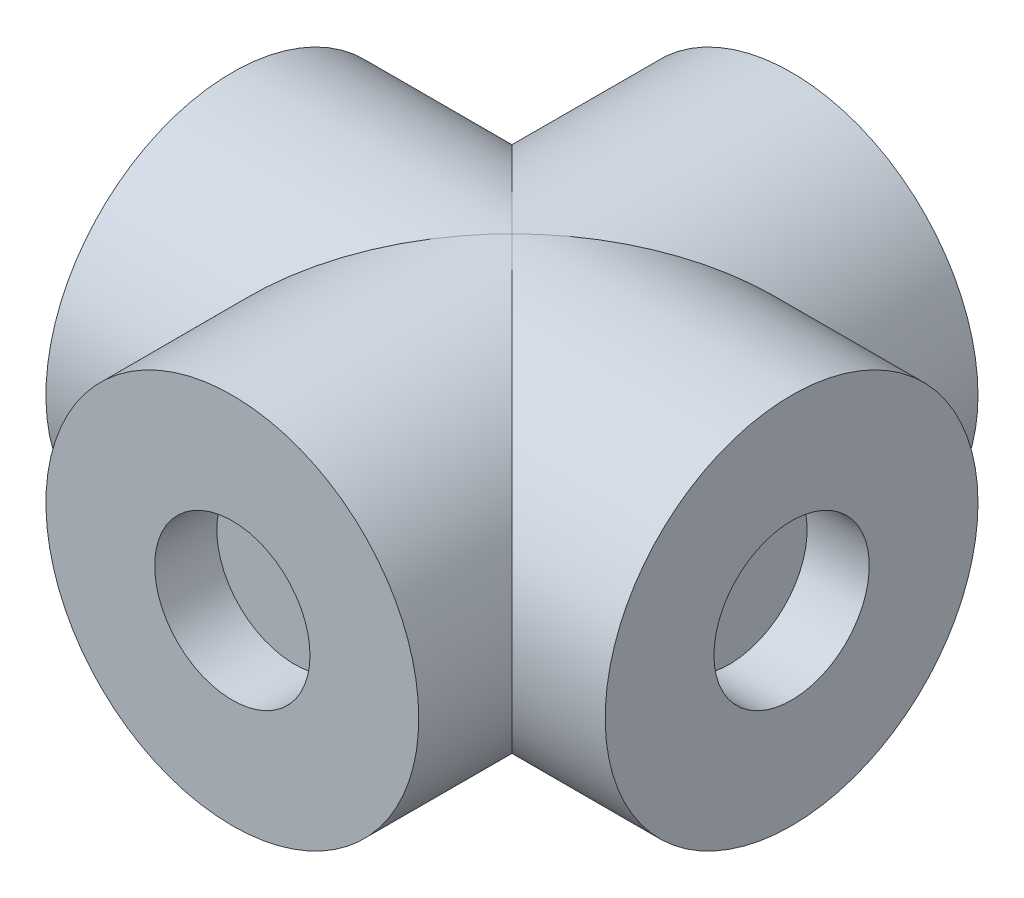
SolidWorks part; units mm, degrees
ref_plane "Front Plane" through (0, 0, 0) normal (0, 0, 1) x (1, 0, 0)
ref_plane "Top Plane" through (0, 0, 0) normal (0, 1, 0) x (1, 0, 0)
ref_plane "Right Plane" through (0, 0, 0) normal (1, 0, 0) x (0, 0, -1)
sketch "Sketch2" plane through (0, 0, 0) normal (0, 0, 1) x (1, 0, 0)
  circle A0 centre (0, 0) radius 30
  dimension "D1" = 60
extrude "Boss-Extrude1" add sketch "Sketch2" along normal mid plane 90
sketch "Sketch4" plane through (0, 0, 45) normal (0, 0, 1) x (1, 0, 0)
  circle A0 centre (0, 0) radius 12.5
  dimension "D1" = 25
extrude "Cut-Extrude1" cut sketch "Sketch4" against normal blind 10
mirror "Mirror1" about plane through (0, 0, 0) normal (0, 0, 1) of "Cut-Extrude1"
sketch "Sketch5" plane through (0, 0, 0) normal (1, 0, 0) x (0, 0, -1)
  line L1 (45, 30) -> (-45, 30) construction
  circle A0 centre (0, 0) radius 30
  point P3 (0, 0)
extrude "Boss-Extrude2" add sketch "Sketch5" along normal mid plane 90
sketch "Sketch6" plane through (-45, 0, 0) normal (-1, 0, 0) x (0, 0, 1)
  circle A0 centre (0, 0) radius 12.5
  dimension "D1" = 25
extrude "Cut-Extrude2" cut sketch "Sketch6" against normal blind 10
mirror "Mirror2" about plane through (0, 0, 0) normal (1, 0, 0) of "Cut-Extrude2"
